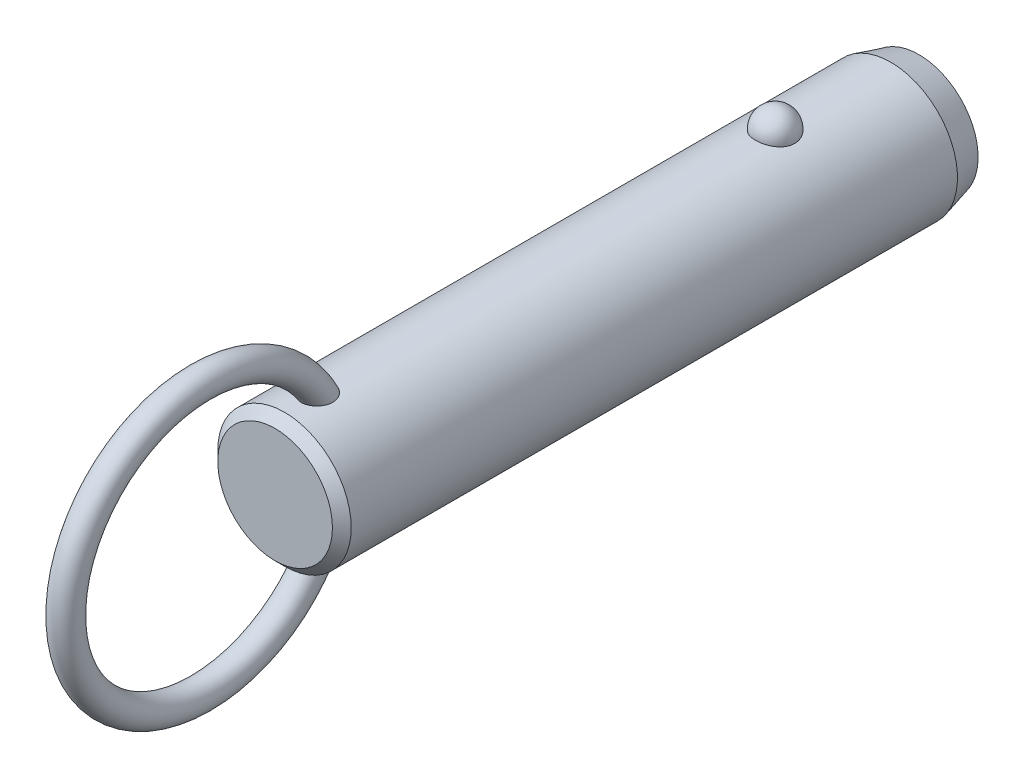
SolidWorks part; units mm, degrees
ref_plane "Front Plane" through (0, 0, 0) normal (0, 0, 1) x (1, 0, 0)
ref_plane "Top Plane" through (0, 0, 0) normal (0, 1, 0) x (1, 0, 0)
ref_plane "Right Plane" through (0, 0, 0) normal (1, 0, 0) x (0, 0, -1)
sketch "Sketch2" plane through (0, 0, 0) normal (0, 0, 1) x (1, 0, 0)
  circle A0 centre (0, 0) radius 7.1
  point P3 (0, 7.1)
  dimension "D1" = 14.2
extrude "Boss-Extrude1" add sketch "Sketch2" along normal blind 43.2
sketch "Sketch3" plane through (0, 0, 0) normal (0, 0, -1) x (-1, 0, 0)
  circle A0 centre (0, 0) radius 7.1
  dimension "D1" = 14.2
extrude "Boss-Extrude2" add sketch "Sketch3" along normal blind 17.4
chamfer "Chamfer1" distance 3 angle 15 1 edges at (-7.1, 0, -17.4)
sketch "Sketch12" plane through (0, 0, 0) normal (1, 0, 0) x (0, 0, -1)
  line L0 (-43.2, 7.1) -> (-43.2, -7.1) construction
  point P0 (-43.2, 0)
sketch "Sketch13" plane through (0, 0, 0) normal (1, 0, 0) x (0, 0, -1)
  circle A0 centre (-59.05, 0) radius 15.85
  point P2 (-43.2, 0)
  dimension "D1" = 31.7
sketch "Sketch14" plane through (0, 0, 0) normal (0, 1, 0) x (1, 0, 0)
  circle A0 centre (0, -44.7) radius 1.5
  point P2 (0, -43.2)
  dimension "D1" = 3
sweep "Sweep1" add profiles "Sketch14" path "Sketch13"
sketch "Sketch15" plane through (0, 0, 43.2) normal (0, 0, 1) x (1, 0, 0)
  circle A0 centre (0, 0) radius 7.1
  dimension "D1" = 14.2
extrude "Boss-Extrude3" add sketch "Sketch15" along normal blind 7.92
chamfer "Chamfer2" distance 1 angle 45 1 edges at (7.1, 0, 51.12)
sketch "Sketch18" plane through (0, 0, 0) normal (1, 0, 0) x (0, 0, -1)
  line L0 (14.4, 7.1) -> (-44.8792, 7.1) construction
  line L1 (2.1, 9.2) -> (2.1, 5)
  line L2 (-44.8792, -7.1) -> (14.4, -7.1) construction
  arc A0 (2.1, 9.2) -> (2.1, 5) centre (2.1, 7.1) ccw
  point P4 (0, 7.1)
  dimension "D1" = 16.3
revolve "Revolve1" add sketch "Sketch18" angle 360 about L1
